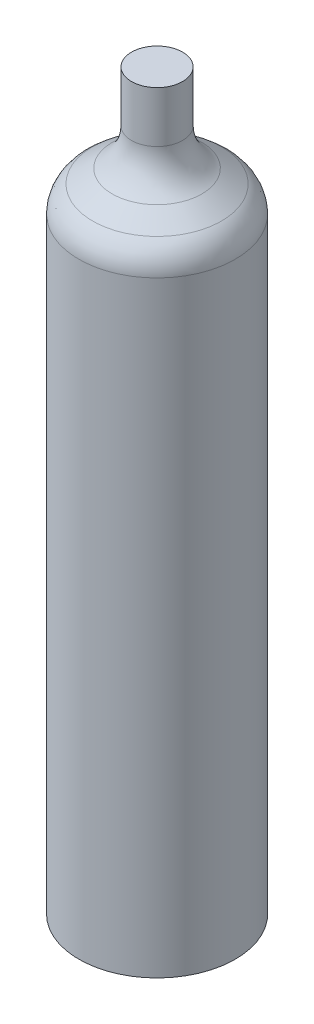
SolidWorks part; units mm, degrees
ref_plane "Plan de face" through (0, 0, 0) normal (0, 0, 1) x (1, 0, 0)
ref_plane "Plan de dessus" through (0, 0, 0) normal (0, 1, 0) x (1, 0, 0)
ref_plane "Plan de droite" through (0, 0, 0) normal (1, 0, 0) x (0, 0, -1)
sketch "Esquisse1" plane through (0, 0, 0) normal (0, 0, 1) x (1, 0, 0)
  line L0 (1.2239, -151.8656) -> (1.2239, 162.4419) construction
  line L6 (11.2239, 118.171) -> (11.2239, 138.171)
  line L7 (26.4738, 98.449) -> (18.7665, 103.7812)
  line L8 (31.8611, -149.3656) -> (31.8611, 88.171)
  line L9 (31.8611, -149.3656) -> (1.2239, -149.3656)
  line L10 (1.2239, 138.171) -> (11.2239, 138.171)
  line L11 (1.2239, 138.171) -> (1.2239, -149.3656)
  line L13 (11.2239, 118.171) -> (11.2239, 203.171) construction
  line L14 (31.8611, -149.3656) -> (31.8611, 88.171) construction
  line L15 (26.4738, 98.449) -> (18.7665, 103.7812) construction
  line L16 (13.7239, 203.171) -> (-11.2761, 203.171) construction
  line L17 (1.2239, 203.171) -> (1.2239, 118.171) construction
  line L18 (31.8611, -149.3656) -> (-29.4133, -149.3656) construction
  arc A2 (11.2239, 118.171) -> (18.7665, 103.7812) centre (28.7218, 118.171) ccw
  arc A3 (31.8611, 88.171) -> (26.4738, 98.449) centre (19.3632, 88.171) ccw
  arc A4 (31.8611, 88.171) -> (26.4738, 98.449) centre (19.3632, 88.171) ccw construction
  arc A5 (31.8611, 88.171) -> (26.4738, 98.449) centre (19.3632, 88.171) ccw construction
  arc A6 (11.2239, 118.171) -> (18.7665, 103.7812) centre (28.7218, 118.171) ccw construction
  dimension "D1" = 65
revolve "Révolution1" add sketch "Esquisse1" angle 360 about L0
